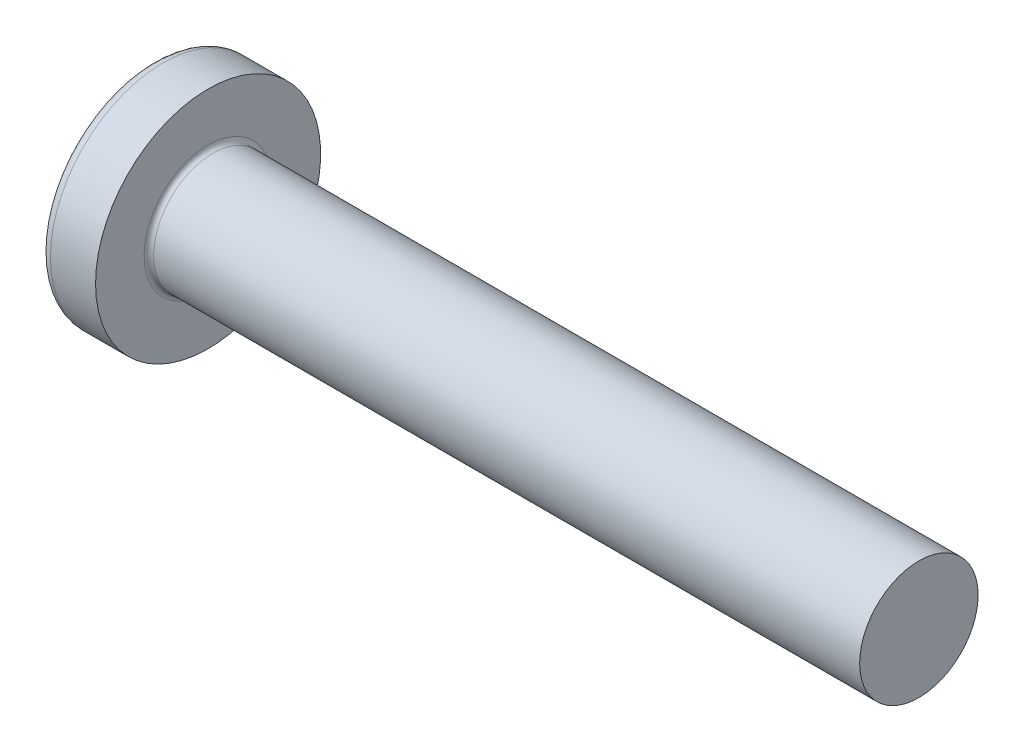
SolidWorks part; units mm, degrees
ref_plane "Plane1" through (0, 0, 0) normal (0, 0, 1) x (1, 0, 0)
ref_plane "Plane2" through (0, 0, 0) normal (0, 1, 0) x (1, 0, 0)
ref_plane "Plane3" through (0, 0, 0) normal (1, 0, 0) x (0, 0, -1)
sketch "BodySke" plane through (0, 0, 0) normal (0, 0, 1) x (1, 0, 0)
  line L0 (3.7, 2.5) -> (3.7, 4.75)
  line L1 (4.1, 6.35) -> (4.1, -3.175) construction
  line L2 (-25.4, 0) -> (127, 0) construction
  line L3 (33.7, 0) -> (0, 0)
  line L4 (3.7, 2.5) -> (33.7, 2.5)
  line L5 (33.7, 2.5) -> (33.7, 0)
  line L6 (1.7942, 4.75) -> (3.7, 4.75)
  line L8 (3.7, 6.35) -> (3.7, -3.175) construction
  arc A0 (1.4243, 4.5563) -> (0, 0) centre (8, 0) ccw
  arc A2 (1.4243, 4.5563) -> (1.7942, 4.75) centre (1.7942, 4.3) cw
revolve "Base-Revolve" add sketch "BodySke"
fillet "Fillet1" radius 0.2 1 edges at (3.7, 0, 2.5)
sketch "Sketch3" plane through (0, 0, 0) normal (1, 0, 0) x (0, 0, -1)
  line L0 (0.515, -2.35) -> (-0.515, -2.35)
  line L1 (0.515, -2.35) -> (0.515, 2.35)
  line L2 (-0.515, 2.35) -> (0.515, 2.35)
  line L3 (-0.515, 2.35) -> (-0.515, -2.35)
ref_plane "Plane4" through (2.74, 0, 0) normal (1, 0, 0) x (0, 0, -1)
sketch "Sketch4" plane through (2.74, 0, 0) normal (1, 0, 0) x (0, 0, -1)
  line L0 (0.515, -0.9839) -> (-0.515, -0.9839)
  line L1 (0.515, -0.9839) -> (0.515, 0.9839)
  line L2 (-0.515, 0.9839) -> (0.515, 0.9839)
  line L3 (-0.515, 0.9839) -> (-0.515, -0.9839)
loft "Recess" cut profiles "Sketch3", "Sketch4"
pattern_circular "RecPat" count 2 every 90 about axis through (0, 0, 0) along (1, 0, 0) of "Recess"
sketch "RecCorSke" plane through (0, 0, 0) normal (0, 0, 1) x (1, 0, 0)
  line L0 (-3.175, 0) -> (15.875, 0) construction
  line L1 (-25.4, 0) -> (127, 0) construction
  line L2 (0, 0) -> (0, 1.0426)
  line L3 (0, 1.0426) -> (2.74, 0.851)
  line L4 (2.74, 0.851) -> (3.0165, 0)
  line L5 (3.0165, 0) -> (0, 0)
revolve "RecessCore" cut sketch "RecCorSke" angle 360 about L0
sketch "ThdSchSke" plane through (0, 0, 0) normal (0, 0, 1) x (1, 0, 0)
  line L0 (5.3, -2.055) -> (4.9884, -2.5)
  line L1 (5.3, -2.055) -> (5.6116, -2.5)
  line L2 (5.6116, -2.5) -> (5.6116, -3.125)
  line L3 (-3.175, 0) -> (5.1513, 0) construction
  line L5 (5.6116, -3.125) -> (4.9884, -3.125)
  line L6 (4.9884, -3.125) -> (4.9884, -2.5)
revolve "ThreadSchematic" [suppressed] cut sketch "ThdSchSke" angle 360 about L3
pattern_linear "ThdSchPat" [suppressed]
equation "\"D1@Sketch3\" = \"Cross_dia@Sketch3\" / 2"
equation "\"D2@Sketch3\" = \"Cross_width@Sketch3\" / 2"
equation "\"Depth@RecCorSke\" = \"Cross_depth@Plane4\""
equation "\"D1@Sketch4\" = \"Cross_width@Sketch3\""
equation "\"D2@Sketch4\" = \"Cross_dia@Sketch3\" - 2.0 * \"Cross_depth@Plane4\" * tan(26.5  * 0.017453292)"
equation "\"D3@Sketch4\" = \"D1@Sketch4\" / 2"
equation "\"D4@Sketch4\" = \"D2@Sketch4\" / 2"
equation "\"Thread_length@ThreadCosmetic\" = ((sgn( (\"Length@BodySke\" - \"Advance@BodySke\" * 2.0 ) - \"Thread_nom@BodySke\" )-1)*( (\"Length@BodySke\" - \"Advance@BodySke\" * 2.0 ) - \"Thread_nom@BodySke\" ))/-2+ \"Thread_"
equation "\"Thread_minor@ThdSchSke\" = \"Thread_minor@ThreadCosmetic\""
equation "\"Diameter@ThdSchSke\" = \"Diameter@BodySke\""
equation "\"Overcut@ThdSchSke\" = \"Diameter@BodySke\" * 1.25"
equation "\"Start@ThdSchSke\" = \"Head_ht@BodySke\" + \"Length@BodySke\" - \"Thread_length@ThreadCosmetic\"  '---Non-countersunk---"
equation "\"Num_threads@ThdSchPat\" = int( \"Thread_length@ThreadCosmetic\" / \"Advance@BodySke\" + 0.999 )  + 1"
equation "\"Advance@ThdSchPat\" = \"Thread_length@ThreadCosmetic\" /  (\"Num_threads@ThdSchPat\" - 1) 'relax it"
